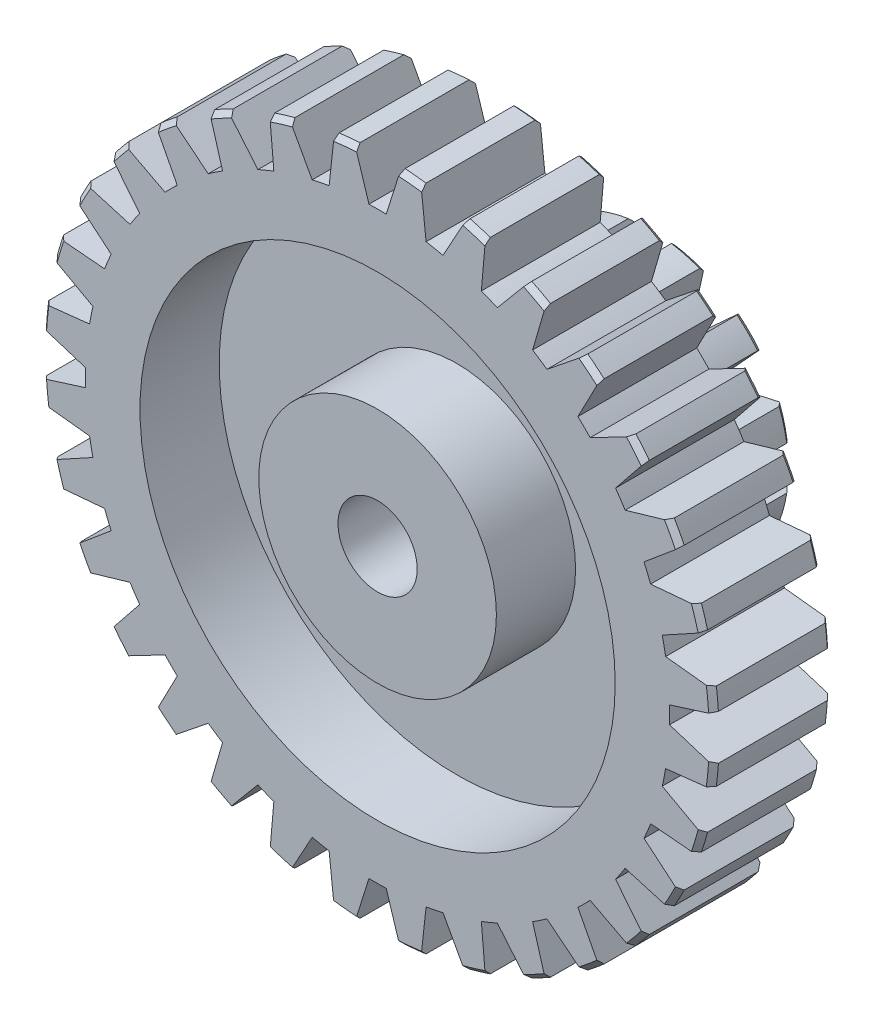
SolidWorks part; units mm, degrees
ref_plane "Plan1" through (0, 0, 0) normal (0, 0, 1) x (1, 0, 0)
ref_plane "Plan2" through (0, 0, 0) normal (0, 1, 0) x (1, 0, 0)
ref_plane "Plan3" through (0, 0, 0) normal (1, 0, 0) x (0, 0, -1)
sketch "Diamètre primitif" plane through (0, 0, 0) normal (0, 0, 1) x (1, 0, 0)
  line L0 (0, 0) -> (0.5, 0) construction
  circle A0 centre (0, 0) radius 8
  point P3 (0, 0)
  dimension "D1" = 16
  dimension "D2" = 0.5
sketch "Esquisse2" plane through (0, 0, 0) normal (0, 0, 1) x (1, 0, 0)
  circle A0 centre (0, 0) radius 8.5
  dimension "D1" = 17
extrude "Diamètre de tête" add sketch "Esquisse2" along normal mid plane 3
chamfer "Chanfreins" distance 0.125 angle 45
sketch "Esquisse3" plane through (0, 0, 0) normal (0, 0, 1) x (1, 0, 0)
  line L0 (0, 0) -> (0, 8.5) construction
  line L1 (-0.2178, 7.3718) -> (-0.5676, 8.481)
  line L2 (0.2178, 7.3718) -> (0.5676, 8.481)
  arc A0 (0.2178, 7.3718) -> (-0.2178, 7.3718) centre (0, 0) ccw
  circle A1 centre (0, 0) radius 8.5 construction
  arc A2 (0.5676, 8.481) -> (-0.5676, 8.481) centre (0, 0) ccw
  point P1 (-0.3927, 7.9264)
  point P10 (0.3927, 7.9264)
  dimension "D1" = 14.75
  dimension "D2" = 0.7854
  dimension "D3" = 325
extrude "Creux dent" cut sketch "Esquisse3" against normal through all and the other way through all
pattern_circular "Répétition" count 32 over 360
sketch "Esquisse5" plane through (0, 0, -1.5) normal (0, 0, -1) x (-1, 0, 0)
  circle A0 centre (0, 0) radius 2
  dimension "D1" = 4
extrude "Extrusion1" add sketch "Esquisse5" along normal blind 4
ref_plane "Plan pignon" through (0, 0, -5.5) normal (0, 0, -1) x (-1, 0, 0)
sketch "Primitif" plane through (0, 0, -5.5) normal (0, 0, -1) x (-1, 0, 0)
  line L0 (0, 0) -> (0.5, 0) construction
  circle A0 centre (0, 0) radius 3
  dimension "D1" = 6
  dimension "D2" = 0.5
sketch "Esquisse31" plane through (0, 0, -5.5) normal (0, 0, -1) x (-1, 0, 0)
  circle A0 centre (0, 0) radius 3.5
  dimension "D1" = 7
extrude "Pignon" add sketch "Esquisse31" against normal up to surface (4 mm away)
chamfer "Chanfreins1" distance 0.125 angle 45
sketch "Esquisse41" plane through (0, 0, -5.5) normal (0, 0, -1) x (-1, 0, 0)
  line L0 (0, 0) -> (0, 3.5) construction
  line L1 (-0.2011, 2.3665) -> (-0.545, 3.4573)
  line L2 (0.2011, 2.3665) -> (0.545, 3.4573)
  arc A0 (0.2011, 2.3665) -> (-0.2011, 2.3665) centre (0, 0) ccw
  circle A1 centre (0, 0) radius 3.5 construction
  arc A2 (0.545, 3.4573) -> (-0.545, 3.4573) centre (0, 0) ccw
  circle A4 centre (0, 0) radius 3 construction
  point P1 (-0.3927, 2.9742)
  point P10 (0.3927, 2.9742)
  dimension "D1" = 4.75
  dimension "D2" = 0.7854
  dimension "D3" = 35
extrude "Creux dent1" cut sketch "Esquisse41" against normal up to surface (4 mm away)
pattern_circular "Répétition circulaire1" count 12 over 360
sketch "Esquisse4" plane through (0, 0, 1.5) normal (0, 0, 1) x (1, 0, 0)
  circle A0 centre (0, 0) radius 1
  dimension "D1" = 2
extrude "Enlèv. mat.-Extru.1" cut sketch "Esquisse4" against normal through all
sketch "Esquisse42" plane through (0, 0, 1.5) normal (0, 0, 1) x (1, 0, 0)
  circle A0 centre (0, 0) radius 4.5
  dimension "D1" = 9
extrude "Enlèv. de mat.-Extru.-Mince2" cut sketch "Esquisse42" against normal blind 2 thin
equation "\"D1@Esquisse2\" = \"D1@Diamètre primitif\" + 2 * \"D2@Diamètre primitif\""
equation "\"D1@Chanfreins\" = 0.25*\"D2@Diamètre primitif\""
equation "\"D1@Esquisse3\" = \"D1@Diamètre primitif\"-2.5*\"D2@Diamètre primitif\""
equation "\"D2@Esquisse3\"=3.14159*\"D2@Diamètre primitif\"/2"
equation "\"D1@Répétition\" = \"D1@Diamètre primitif\"/\"D2@Diamètre primitif\""
equation "\"D1@Esquisse31\" = \"D1@Primitif\"+2*\"D2@Primitif\""
equation "\"D1@Chanfreins1\" = 0.25*\"D2@Primitif\""
equation "\"D1@Esquisse41\" = \"D1@Primitif\"-2.5*\"D2@Primitif\""
equation "\"D2@Esquisse41\" = 3.14159/2*\"D2@Primitif\""
equation "\"D1@Répétition circulaire1\"=\"D1@Primitif\"/\"D2@Primitif\""
